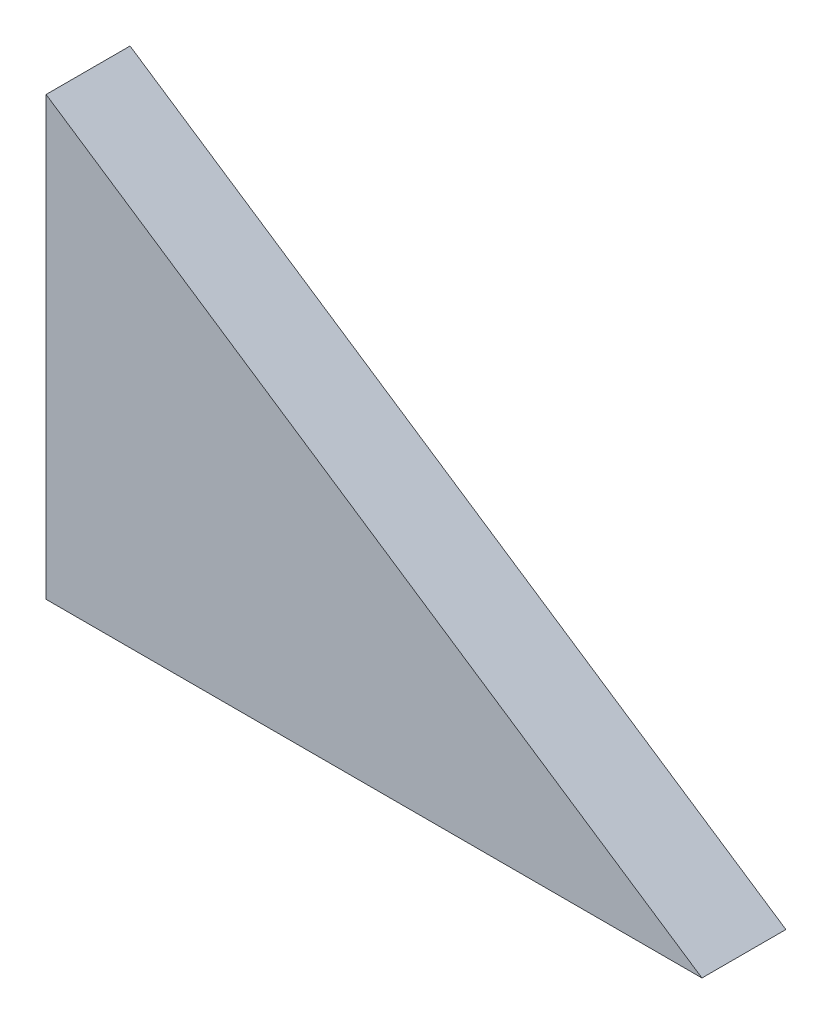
SolidWorks part; units mm, degrees
ref_plane "Front Plane" through (0, 0, 0) normal (0, 0, 1) x (1, 0, 0)
ref_plane "Top Plane" through (0, 0, 0) normal (0, 1, 0) x (1, 0, 0)
ref_plane "Right Plane" through (0, 0, 0) normal (1, 0, 0) x (0, 0, -1)
sketch "Sketch1" plane through (0, 0, 0) normal (0, 0, 1) x (1, 0, 0)
  line L0 (0, 0) -> (0, 6.35)
  line L1 (0, 6.35) -> (9.525, 0)
  line L2 (9.525, 0) -> (0, 0)
  dimension "D1" = 9.525
  dimension "D2" = 6.35
base flange "Base-Flange1" sketch "Sketch1" thickness 1.2192 reverse thickness direction no parameters "D1"=0.7366
sketch "Bend-Lines1" [suppressed] plane through (0, 0, 0) normal (0, 1, 0) x (1, 0, 0)
sketch "Bounding-Box1" [suppressed] plane through (0, 0, 0) normal (0, 1, 0) x (1, 0, 0)
sheet metal parameters "Sheet-Metal1" thickness 1.2192 parameters "D1"=0.7366
flat pattern "Flat-Pattern1"
sketch "Bend-Lines2" plane through (0, 0, 0) normal (0, 1, 0) x (1, 0, 0)
sketch3d "Bounding-Box2" [suppressed]
  line L0 (0, 0, 0) -> (9.525, 0, 0) construction
  line L1 (0, 6.35, 0) -> (9.525, 6.35, 0) construction
  line L2 (0, 0, 0) -> (0, 6.35, 0) construction
  line L3 (9.525, 0, 0) -> (9.525, 6.35, 0) construction
